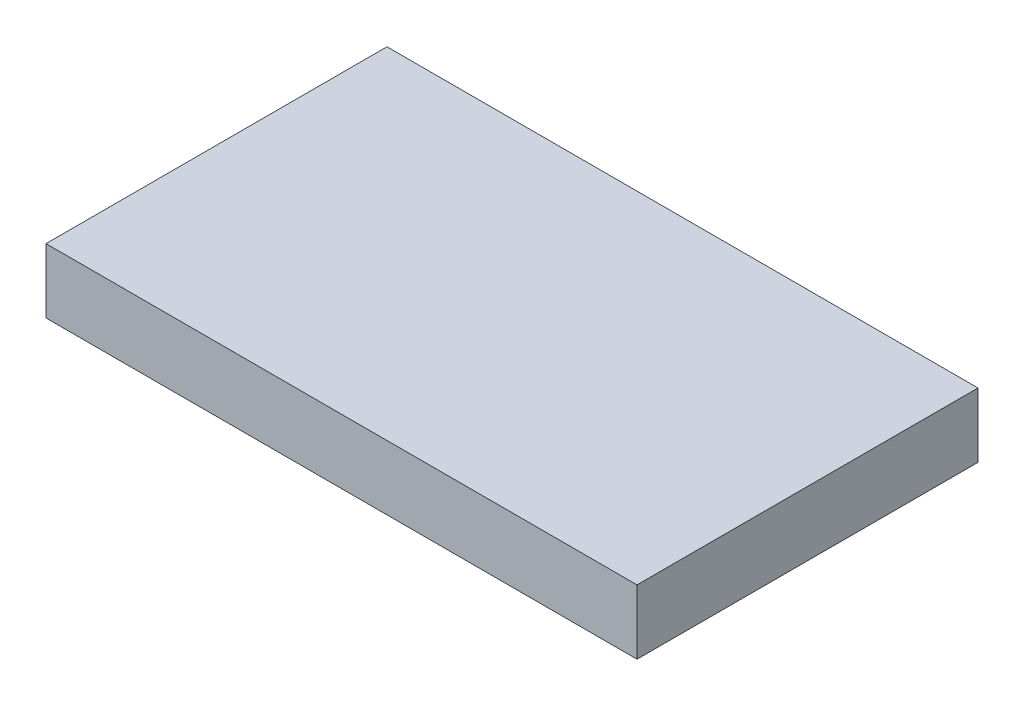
SolidWorks part; units mm, degrees
ref_plane "Plano frontal" through (0, 0, 0) normal (0, 0, 1) x (1, 0, 0)
ref_plane "Plano superior" through (0, 0, 0) normal (0, 1, 0) x (1, 0, 0)
ref_plane "Plano direito" through (0, 0, 0) normal (1, 0, 0) x (0, 0, -1)
sketch "Esboço1" plane through (0, 0, 0) normal (0, 1, 0) x (1, 0, 0)
  line L1 (-78, -45) -> (78, -45)
  line L2 (-78, -45) -> (-78, 45)
  line L3 (-78, 45) -> (78, 45)
  line L4 (78, -45) -> (78, 45)
  line L5 (-78, -45) -> (78, 45) construction
  line L6 (-78, 45) -> (78, -45) construction
  point P0 (0, 0)
  dimension "D1" = 156
  dimension "D2" = 90
extrude "Extrusão1" add sketch "Esboço1" along normal blind 17
